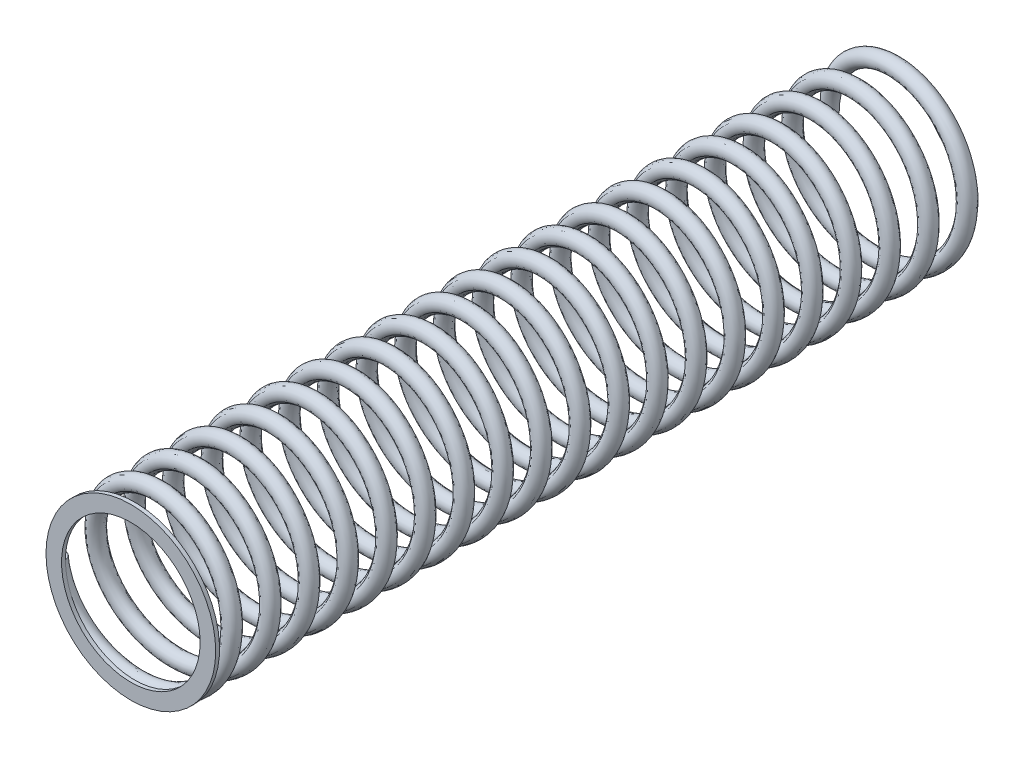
SolidWorks part; units mm, degrees
ref_plane "Front Plane" through (0, 0, 0) normal (0, 0, 1) x (1, 0, 0)
ref_plane "Top Plane" through (0, 0, 0) normal (0, 1, 0) x (1, 0, 0)
ref_plane "Right Plane" through (0, 0, 0) normal (1, 0, 0) x (0, 0, -1)
sketch "Sketch2" plane through (0, 0, 0) normal (0, 0, 1) x (1, 0, 0)
  circle A0 centre (0, 0) radius 20
  dimension "D1" = 40
curve "Helix/Spiral2"
sketch "Sketch6" plane through (0, 0, 0) normal (0, 1, 0) x (1, 0, 0)
  circle A0 centre (-20, 0) radius 2
  dimension "D1" = 4
sweep "Sweep1" add profiles "Sketch6" path "Helix/Spiral2"
ref_plane "Plane2" through (0, 0, 200) normal (0, 0, 1) x (1, 0, 0)
sketch "Sketch7" plane through (0, 0, 0) normal (0, 1, 0) x (1, 0, 0)
  line L0 (-26.4, -200) -> (26.4, -200) construction
  line L1 (-23.0118, -200) -> (21.8006, -200)
  line L2 (-23.0118, -200) -> (-23.0118, -204.546)
  line L3 (-23.0118, -204.546) -> (21.8006, -204.546)
  line L4 (21.8006, -200) -> (21.8006, -204.546)
extrude "Cut-Extrude1" cut sketch "Sketch7" against normal blind 70
sketch "Sketch8" plane through (0, 0, 0) normal (0, 1, 0) x (1, 0, 0)
  line L1 (-22, 0) -> (32.5534, 0)
  line L2 (-22, 0) -> (-22, 16.3563)
  line L3 (-22, 16.3563) -> (32.5534, 16.3563)
  line L4 (32.5534, 0) -> (32.5534, 16.3563)
  circle A0 centre (-20, 0) radius 2 construction
extrude "Cut-Extrude2" cut sketch "Sketch8" along normal blind 92
sketch "Sketch9" plane through (0, 0, 200) normal (0, 0, 1) x (1, 0, 0)
  circle A0 centre (0, 0) radius 21.9212
  circle A1 centre (0, 0) radius 17.9023
extrude "Boss-Extrude1" add sketch "Sketch9" along normal blind 1
